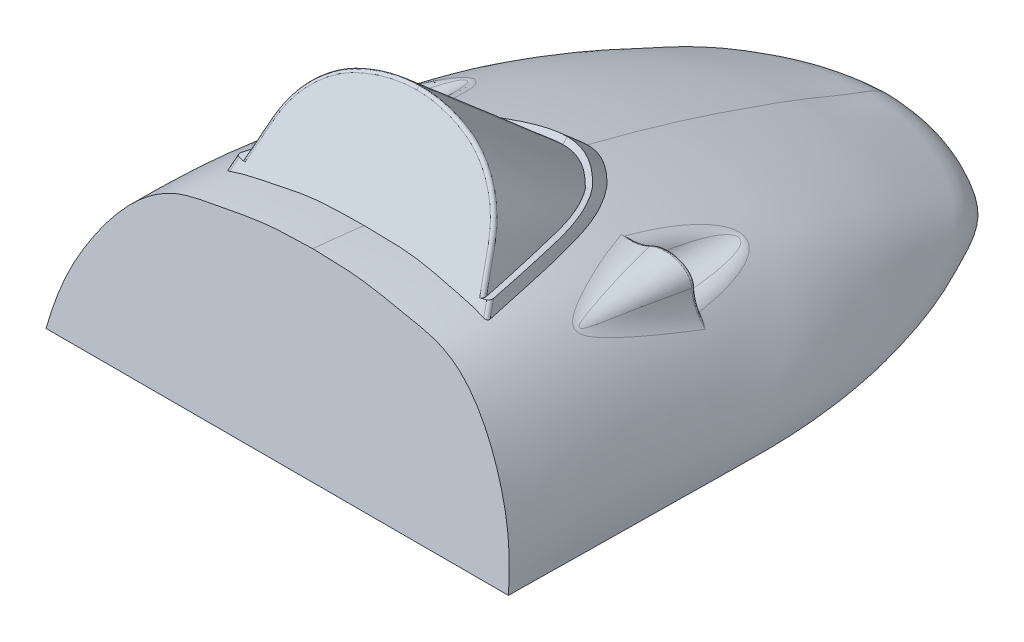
SolidWorks part; units mm, degrees
ref_plane "Front" through (0, 0, 0) normal (0, 0, 1) x (1, 0, 0)
ref_plane "Top"
ref_plane "Right" through (0, 0, 0) normal (1, 0, 0) x (0, 0, -1)
sketch "Sketch1" plane through (0, 0, 0) normal (0, 1, 0) x (1, 0, 0)
  line L0 (0, 0) -> (0, 1220)
  line L1 (0, 0) -> (-457, 0)
  line L2 (-457, 0) -> (-463.5, 482.6)
  line L3 (0, 482.6) -> (-463.5, 482.6) construction
  line L4 (0, 1118) -> (-269.1096, 1118) construction
  line L9 (0, 1220) -> (124.4514, 1220) construction
  arc A3 (0, 1220) -> (-269.1096, 1118) centre (0, 814) ccw
  arc A4 (-269.1096, 1118) -> (-292.386, 1090.5984) centre (-184.93, 1022.9064) ccw
  arc A5 (-292.386, 1090.5984) -> (-463.5, 482.6) centre (648.9806, 497.5837) ccw
  dimension "D9" = 406
  dimension "D3" = 463.5
  dimension "D6" = 127
  dimension "D4" = 1112.5815
  dimension "D1" = 457
  dimension "D2" = 1220
  dimension "D5" = 482.6
  dimension "D7" = 1118
  dimension "D8" = 90.772
sketch "Sketch2" plane through (0, 0, 0) normal (1, 0, 0) x (0, 0, -1)
  line L0 (0, 0) -> (70.1437, 330)
  line L1 (1220, 0) -> (1218.8626, 13)
  line L2 (1220, 0) -> (0, 0)
  line L4 (171.7437, 318.9435) -> (171.7437, 0)
  line L5 (966, 129.233) -> (724.2421, 207.1374) construction
  line L7 (482.6, 0) -> (482.6, 267) construction
  arc A0 (1218.8626, 13) -> (1204.0788, 33.6808) centre (1193.9578, 10.8211) ccw
  arc A4 (1204.0788, 33.6808) -> (70.1437, 330) centre (-273.999, -3304.7371) ccw
  dimension "D2" = 25
  dimension "D3" = 78
  dimension "D5" = 85
  dimension "D8" = 101.6
  dimension "D7" = 3650.9928
  dimension "D1" = 13
  dimension "D4" = 330
  dimension "D6" = 267
  dimension "D9" = 254
  dimension "D10" = 254
imported_body "Imported1"
ref_plane "Plane1" through (0, 0, -482) normal (0, 0, 1) x (1, 0, 0)
sketch "Sketch15" plane through (0, 0, -482) normal (0, 0, 1) x (1, 0, 0)
  line L0 (-292, 232) -> (-292, 270) construction
  line L1 (-292, 232) -> (-346, 232) construction
  line L2 (-437.534, 0) -> (0, 0) construction
  line L3 (0, 0) -> (0, 330.2) construction
  ellipse E0 centre (-292, 232) end of major axis (-346, 232) minor radius 38
  dimension "D1" = 232
  dimension "D2" = 292
  dimension "D3" = 108
  dimension "D4" = 76
ref_plane "Plane2" through (0, 0, -228) normal (0, 0, 1) x (1, 0, 0)
sketch "Sketch16" plane through (0, 0, -228) normal (0, 0, 1) x (1, 0, 0)
  line L0 (-292, 232) -> (-292, 270) construction
  ellipse E0 centre (-292, 232) end of major axis (-330.1, 232) minor radius 25.4
  dimension "D1" = 50.8
  dimension "D2" = 76.2
ref_plane "Plane3" through (0, 399.0782, -128.5996) normal (0, 0.9518, -0.3067) x (1, 0, 0)
loft "Boss-Loft1" add profiles "Sketch15", "Sketch16"
sketch "Sketch17" plane through (0, 0, -482) normal (0, 0, -1) x (-1, 0, 0)
  ellipse E0 centre (292, 232) end of major axis (346, 232) minor radius 38
extrude "Cut-Extrude1" cut sketch "Sketch17" along normal through all
fillet "Fillet1" radius 76 1 edges at (-320.9532, 247.7793, -276.0074)
fillet "Fillet2" radius 38 3 edges at (-268.5811, 197.7595, -647.9986)
fillet "Fillet3" radius 6.5 9 edges at (-319.0556, 249.2788, -279.2964) (-229.1196, 252.151, -482) (-354.3621, 195.5457, -482) (-230.6118, 238.8786, -482)
fillet "Fillet4" radius 3 10 edges at (-276.3928, 194.2611, -651.5235) (-265.5833, 198.8575, -641.9543) (-327.46, 199.3249, -482) (-230.6118, 238.8786, -482) (-219.4612, 247.4088, -481.6821) (-360.6934, 182.4181, -479.8992)
mirror "Boss-Mirror1"
imported_body "Surface-Imported1"
other "Intersect1"
